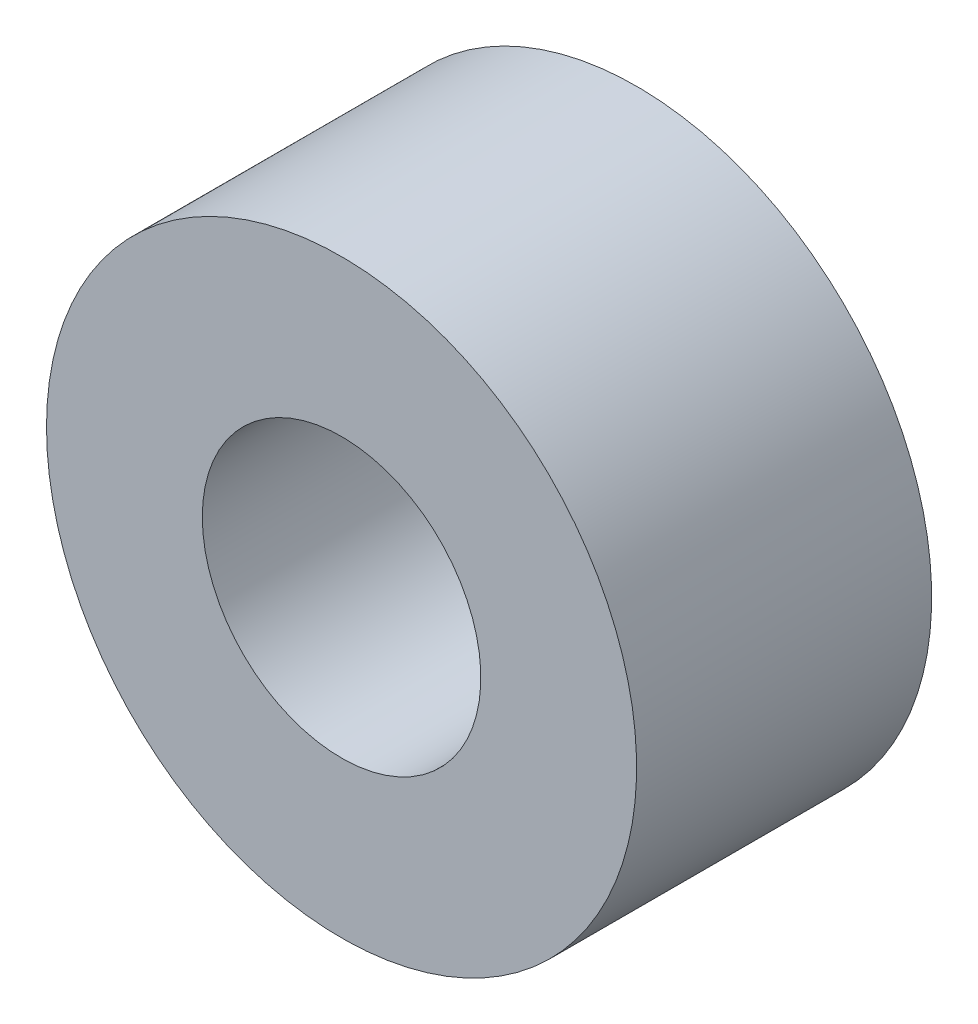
SolidWorks part; units mm, degrees
ref_plane "Front Plane" through (0, 0, 0) normal (0, 0, 1) x (1, 0, 0)
ref_plane "Top Plane" through (0, 0, 0) normal (0, 1, 0) x (1, 0, 0)
ref_plane "Right Plane" through (0, 0, 0) normal (1, 0, 0) x (0, 0, -1)
ref_plane "Plane1" through (0, 0, 0) normal (0, 0, -1) x (-1, 0, 0)
sketch "Sketch1" plane through (0, 0, 0) normal (0, 0, -1) x (-1, 0, 0)
  line L0 (-3.6662, 0) -> (-1.8331, 3.175) construction
  line L1 (-1.8331, 3.175) -> (1.8331, 3.175) construction
  line L2 (1.8331, 3.175) -> (3.6662, 0) construction
  line L3 (3.6662, 0) -> (1.8331, -3.175) construction
  line L4 (1.8331, -3.175) -> (-1.8331, -3.175) construction
  line L5 (-1.8331, -3.175) -> (-3.6662, 0) construction
  circle A0 centre (0, 0) radius 3.175
  dimension "D1" = 6.35
extrude "Extrude1" add sketch "Sketch1" along normal blind 3.175
hole_wizard "#31 (0.12) Diameter Hole1" positions "Sketch4" profile "Sketch3" hole size "#31" standard "Ansi Inch"
sketch "Sketch4" plane through (0, 0, -3.175) normal (0, 0, -1) x (-1, 0, 0)
  point P0 (0, 0)
sketch "Sketch3" plane through (0, 0, -3.175) normal (1, 0, 0) x (0, 1, 0)
  line L0 (0, 0) -> (0, 3.175)
  line L1 (0, 3.175) -> (1.4986, 3.175)
  line L2 (1.4986, 3.175) -> (1.4986, 0)
  line L5 (1.4986, 0) -> (0, 0)
  line L11 (0, -6.35) -> (0, 107.95) construction
  dimension "Thru Hole Dia." = 2.9972
  dimension "Thru Hole Depth" = 3.175
